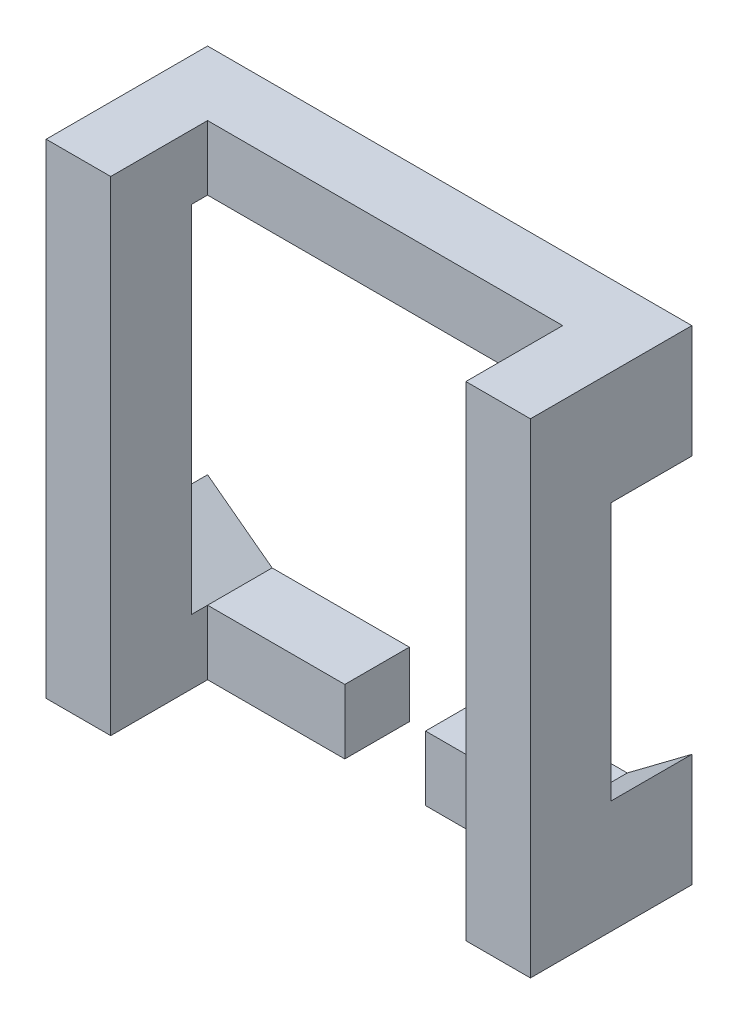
SolidWorks part; units mm, degrees
ref_plane "Front Plane" through (0, 0, 0) normal (0, 0, 1) x (1, 0, 0)
ref_plane "Top Plane" through (0, 0, 0) normal (0, 1, 0) x (1, 0, 0)
ref_plane "Right Plane" through (0, 0, 0) normal (1, 0, 0) x (0, 0, -1)
sketch "Sketch1" plane through (0, 0, 0) normal (0, 0, 1) x (1, 0, 0)
  line L5 (0, 0) -> (6, 0)
  line L6 (0, 0) -> (0, 6)
  line L7 (0, 6) -> (6, 6)
  line L8 (6, 0) -> (6, 6)
  dimension "D1" = 6
extrude "Boss-Extrude1" add sketch "Sketch1" along normal blind 2
sketch "Sketch2" plane through (0, 0, 0) normal (0, 0, -1) x (-1, 0, 0)
  line L0 (-5.2, 5.2) -> (-0.8, 5.2)
  line L1 (-6, 6) -> (0, 6) construction
  line L2 (0, 6) -> (0, 0) construction
  line L3 (-6, 0) -> (-6, 6) construction
  line L4 (-0.8, 5.2) -> (0, 4.6)
  line L5 (-5.2, 5.2) -> (-6, 4.6)
  line L6 (-8.7951, 3) -> (3.6626, 3) construction
  line L7 (0, 0) -> (-6, 0) construction
  line L8 (-0.8, 0.8) -> (0, 1.4)
  line L9 (-5.2, 0.8) -> (-0.8, 0.8)
  line L10 (-5.2, 0.8) -> (-6, 1.4)
  line L11 (-6, 4.6) -> (-6, 1.4)
  line L12 (0, 4.6) -> (0, 1.4)
  dimension "D1" = 0.8
  dimension "D2" = 0.8
  dimension "D3" = 0.8
  dimension "D4" = 1.4
extrude "Cut-Extrude1" cut sketch "Sketch2" against normal blind 1
sketch "Sketch3" plane through (0, 0, 1) normal (0, 0, -1) x (-1, 0, 0)
  line L0 (-0.8, 5.2) -> (-5.2, 5.2) construction
  line L1 (-0.8, 0.8) -> (-5.2, 0.8)
  line L2 (-0.8, 0.8) -> (-0.8, 5.2)
  line L3 (-0.8, 5.2) -> (-5.2, 5.2)
  line L4 (-5.2, 0.8) -> (-5.2, 5.2)
  line L5 (-5.2, 0.8) -> (-0.8, 0.8) construction
extrude "Cut-Extrude2" cut sketch "Sketch3" against normal blind 1
sketch "Sketch4" plane through (0, 0, 0) normal (0, -1, 0) x (1, 0, 0)
  line L0 (0, 2) -> (6, 2) construction
  line L1 (5.2, 2) -> (0.8, 2)
  line L2 (5.2, 2) -> (5.2, 0.8)
  line L3 (5.2, 0.8) -> (0.8, 0.8)
  line L4 (0.8, 2) -> (0.8, 0.8)
  line L5 (6, 2) -> (6, 0) construction
  line L6 (0, 2) -> (0, 0) construction
  line L7 (0, 0) -> (6, 0) construction
  dimension "D1" = 0.8
  dimension "D2" = 0.8
  dimension "D3" = 0.8
extrude "Cut-Extrude3" cut sketch "Sketch4" against normal through all
sketch "Sketch5" plane through (0, 0, 0) normal (0, 0, -1) x (-1, 0, 0)
  line L0 (-5.2, 0.8) -> (-0.8, 0.8) construction
  line L1 (-2.5, 0.8) -> (-3.5, 0.8)
  line L2 (-2.5, 0.8) -> (-2.5, 0)
  line L3 (-2.5, 0) -> (-3.5, 0)
  line L4 (-3.5, 0.8) -> (-3.5, 0)
  line L5 (0, 0) -> (-6, 0) construction
  line L6 (-3, 2.6955) -> (-3, -1.0844) construction
  line L7 (0, 1.4) -> (0, 0) construction
  line L8 (-6, 0) -> (-6, 1.4) construction
  dimension "D1" = 1
extrude "Cut-Extrude4" cut sketch "Sketch5" against normal up to next
